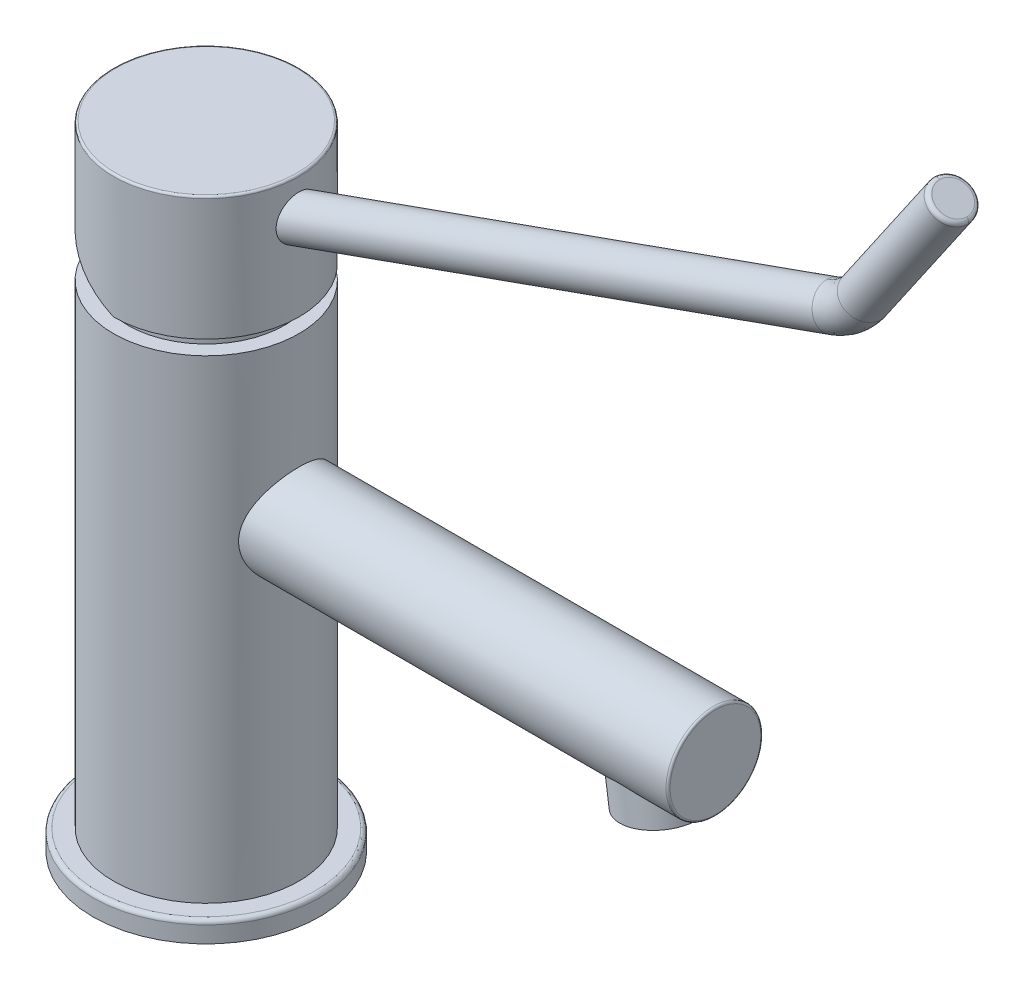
SolidWorks part; units mm, degrees
ref_plane "Front Plane" through (0, 0, 0) normal (0, 0, 1) x (1, 0, 0)
ref_plane "Top Plane" through (0, 0, 0) normal (0, 1, 0) x (1, 0, 0)
ref_plane "Right Plane" through (0, 0, 0) normal (1, 0, 0) x (0, 0, -1)
imported_body "Imported1"
fillet "Fillet1" radius 0.5
fillet "Fillet2" radius 0.5 1 edges at (123.5, 92, 0)
fillet "Fillet3" radius 1 1 edges at (0, 5, 27.5)
